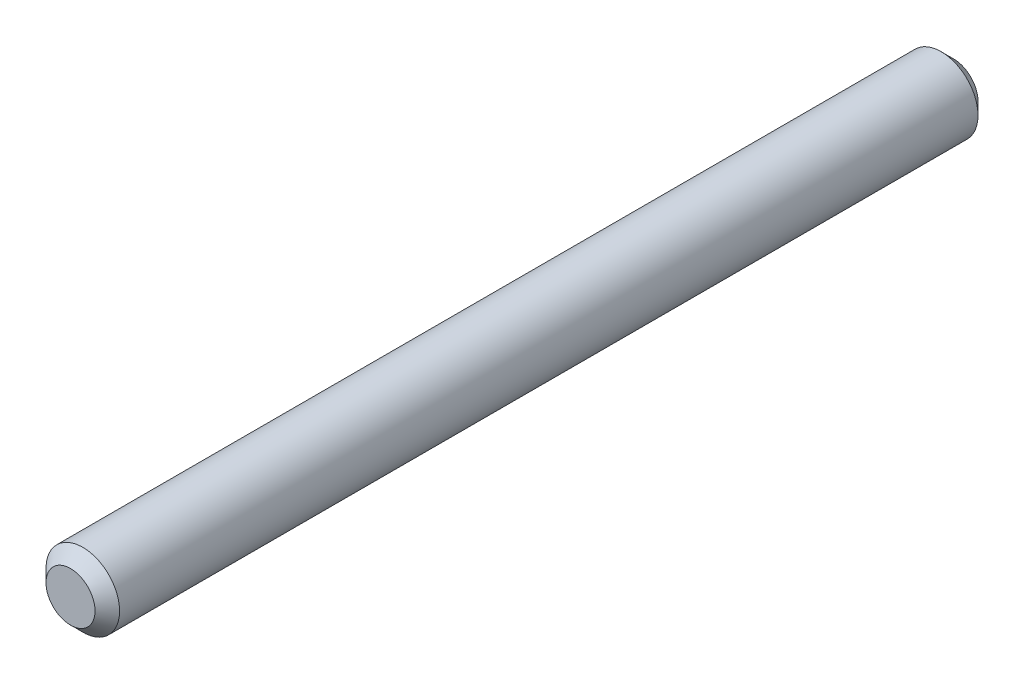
SolidWorks part; units mm, degrees
ref_plane "Plan de face" through (0, 0, 0) normal (0, 0, 1) x (1, 0, 0)
ref_plane "Plan de dessus" through (0, 0, 0) normal (0, 1, 0) x (1, 0, 0)
ref_plane "Plan de droite" through (0, 0, 0) normal (1, 0, 0) x (0, 0, -1)
sketch "Esquisse1" plane through (0, 0, 0) normal (0, 0, 1) x (1, 0, 0)
  circle A0 centre (0, 0) radius 1.5
extrude "Extrusion1" add sketch "Esquisse1" along normal blind 36
chamfer "Chanfrein1" distance 0.5 angle 45 2 edges at (1.5, 0, 0) (1.5, 0, 36)
